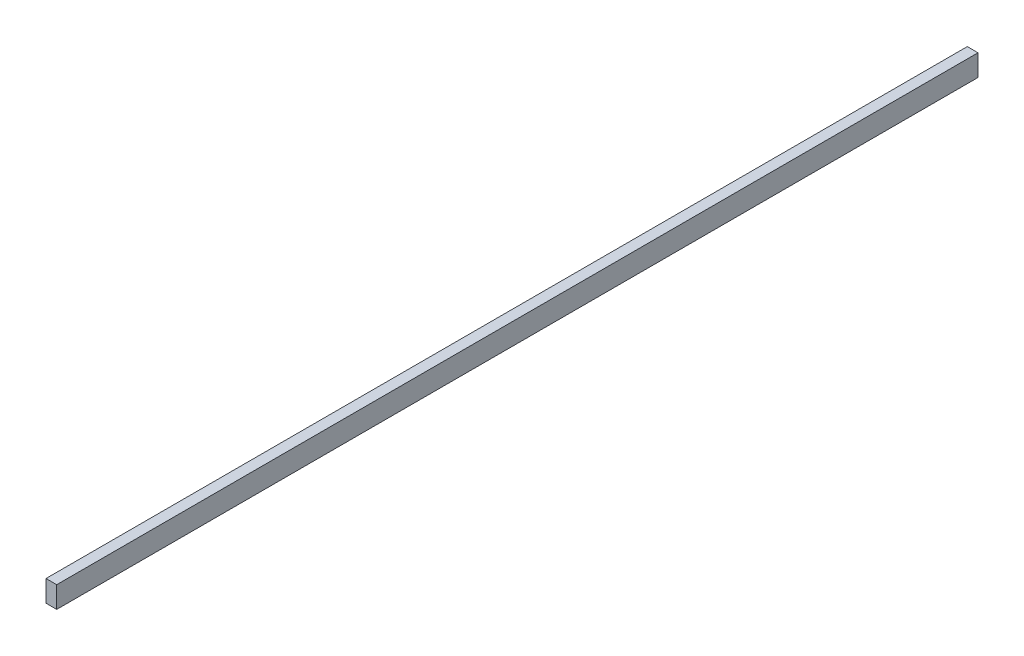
SolidWorks part; units mm, degrees
ref_plane "Face" through (0, 0, 0) normal (0, 0, 1) x (1, 0, 0)
ref_plane "Dessus" through (0, 0, 0) normal (0, 1, 0) x (1, 0, 0)
ref_plane "Droite" through (0, 0, 0) normal (1, 0, 0) x (0, 0, -1)
sketch "Esquisse1" plane through (0, 0, 0) normal (0, 0, 1) x (1, 0, 0)
  line L1 (0, 0) -> (5, 0)
  line L2 (0, 0) -> (0, 10)
  line L3 (0, 10) -> (5, 10)
  line L4 (5, 0) -> (5, 10)
  dimension "D1" = 5
  dimension "D2" = 10
extrude "Extrusion1" add sketch "Esquisse1" along normal blind 430
